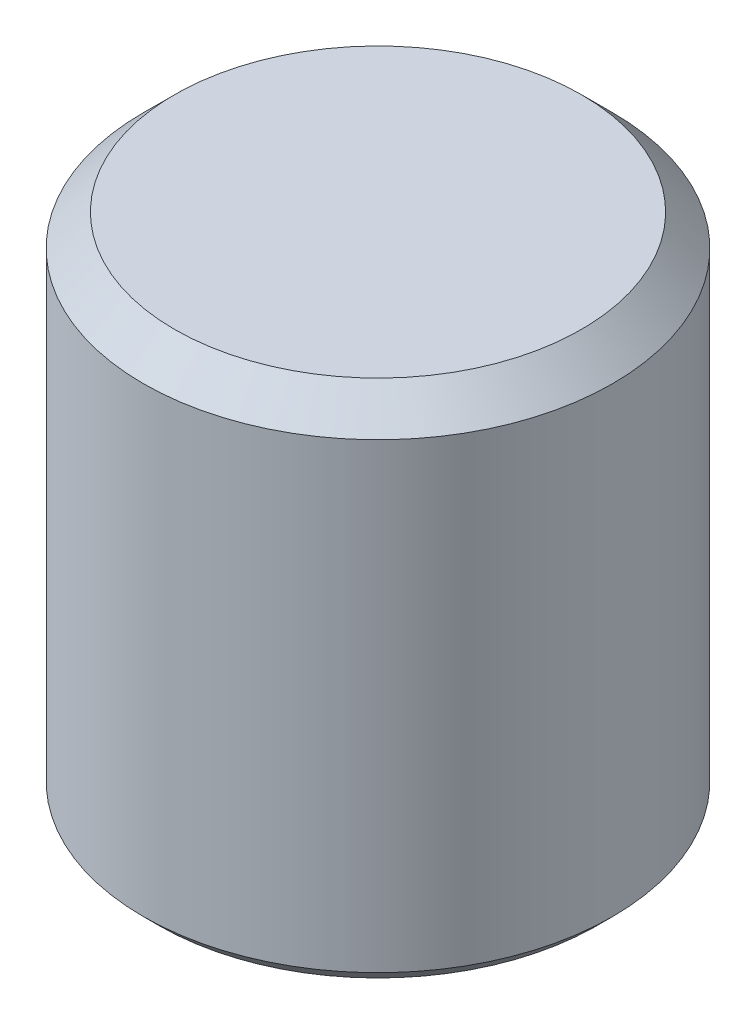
SolidWorks part; units mm, degrees
ref_plane "Front Plane" through (0, 0, 0) normal (0, 0, 1) x (1, 0, 0)
ref_plane "Top Plane" through (0, 0, 0) normal (0, 1, 0) x (1, 0, 0)
ref_plane "Right Plane" through (0, 0, 0) normal (1, 0, 0) x (0, 0, -1)
sketch "Sketch1" plane through (0, 0, 0) normal (0, 1, 0) x (1, 0, 0)
  circle A0 centre (0, 0) radius 6
  dimension "D1" = 12
extrude "Boss-Extrude1" add sketch "Sketch1" along normal blind 13
sketch "Sketch2" plane through (0, 0, 0) normal (0, -1, 0) x (1, 0, 0)
  circle A0 centre (0, 0) radius 5
  dimension "D1" = 10
extrude "Cut-Extrude1" cut sketch "Sketch2" against normal blind 10 contours A0
chamfer "Chamfer1" distance 0.8 angle 45 1 edges at (0, 13, 6)
chamfer "Chamfer2" distance 0.4 angle 45 2 edges at (0, 0, 6) (0, 0, -5)
